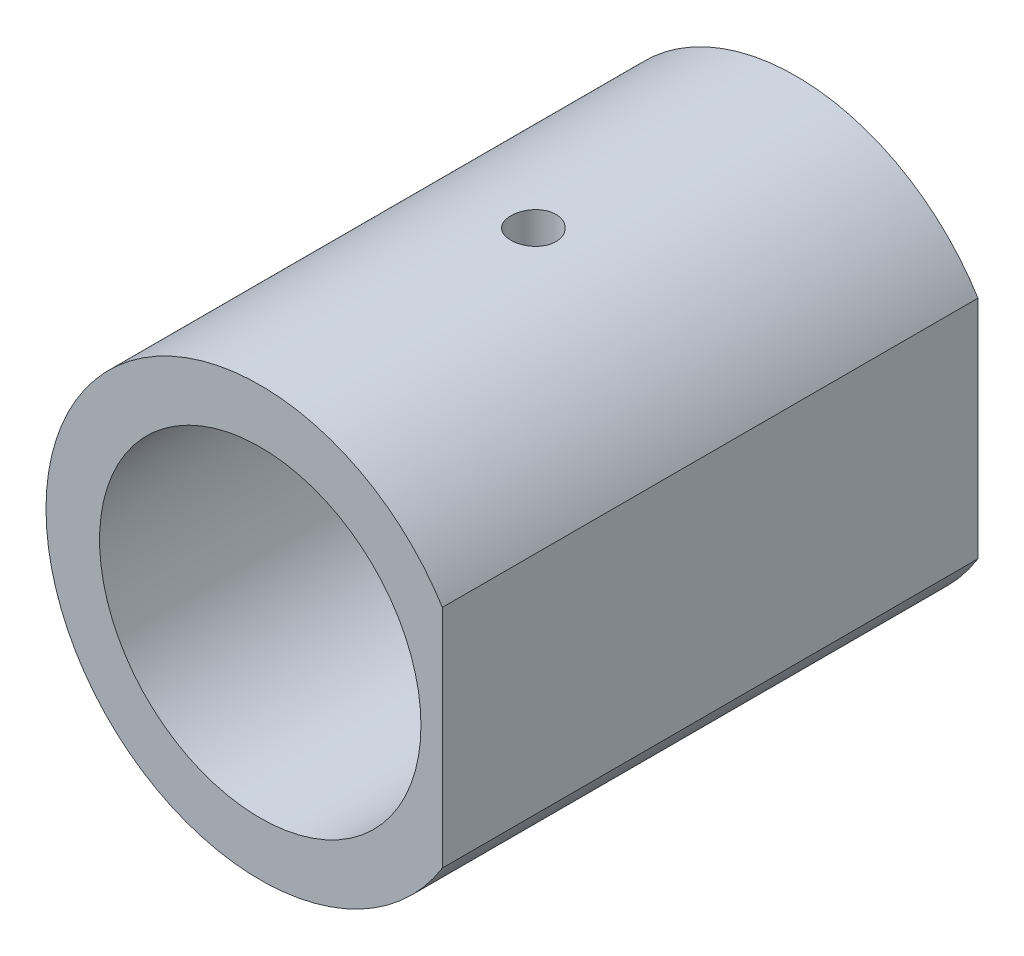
SolidWorks part; units mm, degrees
ref_plane "Frontal" through (0, 0, 0) normal (0, 0, 1) x (1, 0, 0)
ref_plane "Horizontal" through (0, 0, 0) normal (0, 1, 0) x (1, 0, 0)
ref_plane "Vertical" through (0, 0, 0) normal (1, 0, 0) x (0, 0, -1)
imported_body "Importée1"
sketch "Esquisse1" plane through (0, 0, 25) normal (0, 0, 1) x (1, 0, 0)
  circle A0 centre (0, 0) radius 15
  dimension "D1" = 30
extrude "Extrusion1" cut sketch "Esquisse1" against normal through all
other "SupprimerFace1"
hole_wizard "Trou taraudé M51" positions "Esquisse3D3" profile "Esquisse6" tap size "M5" standard "ISO"
sketch3d "Esquisse3D3"
  line L0 (0, 0, 0) -> (0, 0, -21.3443) construction
  point P1 (0, 0, 0)
  point P10 (-0.0118, 20, -0.5103)
sketch "Esquisse6" plane through (-0.0118, 20, -0.5103) normal (0, 0, 1) x (-1, -0.0006, 0)
  line L0 (0, 0) -> (0, 20)
  line L1 (0, 20) -> (2.1, 20)
  line L2 (2.1, 20) -> (2.1, 0)
  line L5 (2.1, 0) -> (0, 0)
  line L11 (0, -6.35) -> (0, 107.95) construction
  dimension "Diamètre du trou pour taraudage jusqu'au prochain" = 4.2
  dimension "Profondeur du trou pour taraudage jusqu'au prochain" = 20
